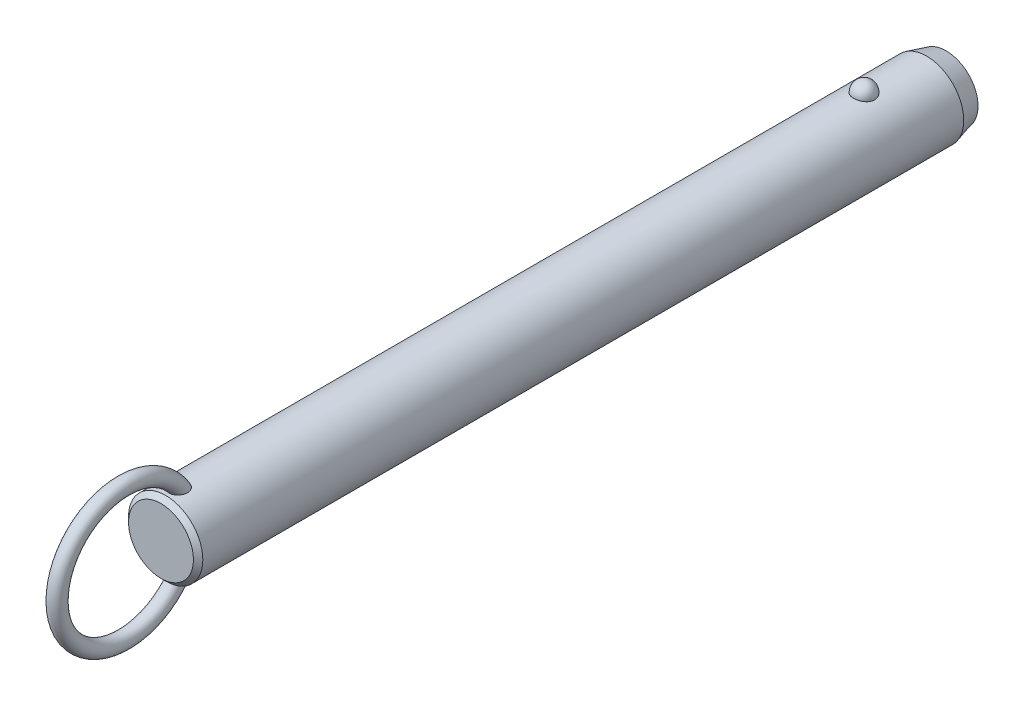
SolidWorks part; units mm, degrees
ref_plane "Front Plane" through (0, 0, 0) normal (0, 0, 1) x (1, 0, 0)
ref_plane "Top Plane" through (0, 0, 0) normal (0, 1, 0) x (1, 0, 0)
ref_plane "Right Plane" through (0, 0, 0) normal (1, 0, 0) x (0, 0, -1)
sketch "Sketch2" plane through (0, 0, 0) normal (0, 0, 1) x (1, 0, 0)
  circle A0 centre (0, 0) radius 9.5
  point P3 (0, 9.5)
  dimension "D1" = 19
extrude "Boss-Extrude1" add sketch "Sketch2" along normal blind 167.6
sketch "Sketch3" plane through (0, 0, 0) normal (0, 0, -1) x (-1, 0, 0)
  circle A0 centre (0, 0) radius 9.5
  dimension "D1" = 19
extrude "Boss-Extrude2" add sketch "Sketch3" along normal blind 23.7
chamfer "Chamfer1" distance 5 angle 15 1 edges at (-9.5, 0, -23.7)
sketch "Sketch12" plane through (0, 0, 0) normal (1, 0, 0) x (0, 0, -1)
  line L0 (-167.6, 9.5) -> (-167.6, -9.5) construction
  point P0 (-167.6, 0)
sketch "Sketch13" plane through (0, 0, 0) normal (1, 0, 0) x (0, 0, -1)
  circle A0 centre (-186.65, 0) radius 19.05
  point P2 (-167.6, 0)
  dimension "D1" = 38.1
sketch "Sketch14" plane through (0, 0, 0) normal (0, 1, 0) x (1, 0, 0)
  circle A0 centre (0, -169.6) radius 2
  point P2 (0, -167.6)
  dimension "D1" = 4
sweep "Sweep1" add profiles "Sketch14" path "Sketch13"
sketch "Sketch15" plane through (0, 0, 167.6) normal (0, 0, 1) x (1, 0, 0)
  circle A0 centre (0, 0) radius 9.5
  dimension "D1" = 19
extrude "Boss-Extrude3" add sketch "Sketch15" along normal blind 9.52
chamfer "Chamfer2" distance 1.2 angle 45 1 edges at (9.5, 0, 177.12)
sketch "Sketch18" plane through (0, 0, 0) normal (1, 0, 0) x (0, 0, -1)
  line L0 (18.7, 9.5) -> (-170.1378, 9.5) construction
  line L1 (2.7, 12.2) -> (2.7, 6.8)
  line L2 (-170.1378, -9.5) -> (18.7, -9.5) construction
  arc A0 (2.7, 12.2) -> (2.7, 6.8) centre (2.7, 9.5) ccw
  point P4 (0, 9.5)
  dimension "D1" = 21.7
revolve "Revolve1" add sketch "Sketch18" angle 360 about L1
